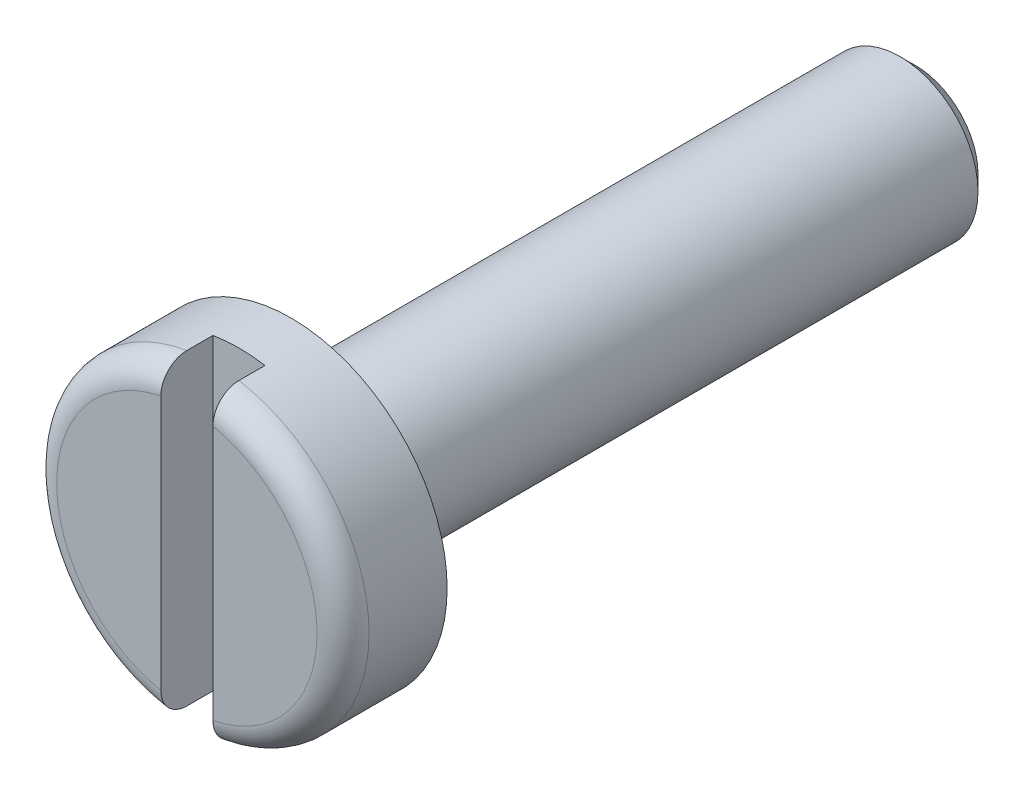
SolidWorks part; units mm, degrees
ref_plane "Plan de face" through (0, 0, 0) normal (0, 0, 1) x (1, 0, 0)
ref_plane "Plan de dessus" through (0, 0, 0) normal (0, 1, 0) x (1, 0, 0)
ref_plane "Plan de droite" through (0, 0, 0) normal (1, 0, 0) x (0, 0, -1)
sketch "Esquisse1" plane through (0, 0, 0) normal (0, 0, 1) x (1, 0, 0)
  circle A0 centre (0, 0) radius 1.5
extrude "Extrusion1" add sketch "Esquisse1" along normal blind 12
sketch "Esquisse2" plane through (0, 0, 12) normal (0, 0, 1) x (1, 0, 0)
  circle A0 centre (0, 0) radius 3
extrude "Extrusion2" add sketch "Esquisse2" along normal blind 2
fillet "Congé1" radius 0.5 1 edges at (3, 0, 14)
chamfer "Chanfrein1" distance 0.3 angle 45 1 edges at (1.5, 0, 0)
sketch "Esquisse3" plane through (0, 0, 14) normal (0, 0, 1) x (1, 0, 0)
  line L0 (-0.5, 3.2286) -> (0.5, 3.2286)
  line L1 (-0.5, 3.2286) -> (-0.5, -3.3817)
  line L2 (0.5, 3.2286) -> (0.5, -3.3817)
  line L3 (-0.5, -3.3817) -> (0.5, -3.3817)
extrude "Enlèv. mat.-Extru.1" cut sketch "Esquisse3" against normal blind 1
